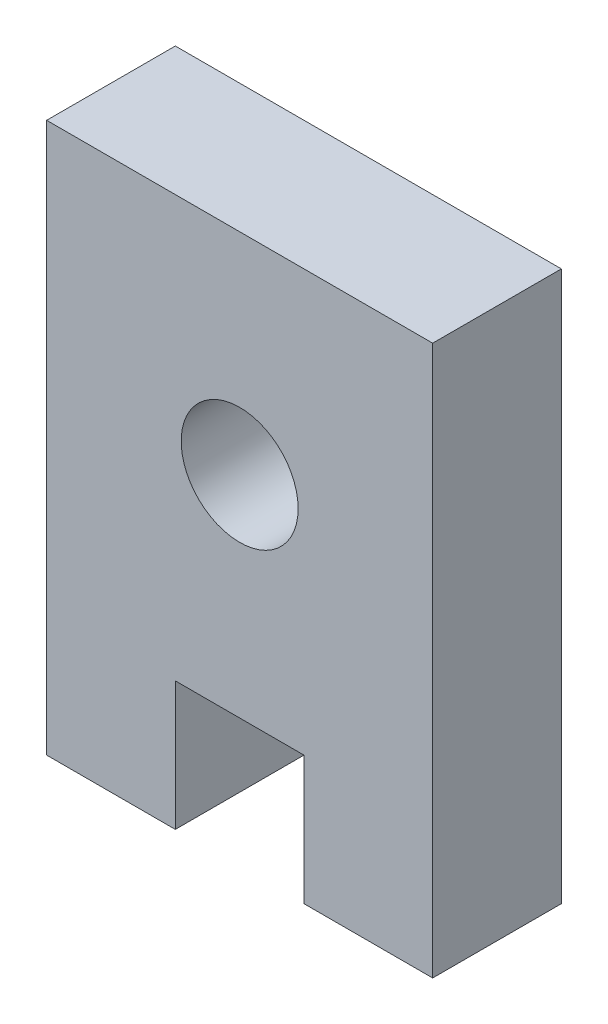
SolidWorks part; units mm, degrees
ref_plane "Front Plane" through (0, 0, 0) normal (0, 0, 1) x (1, 0, 0)
ref_plane "Top Plane" through (0, 0, 0) normal (0, 1, 0) x (1, 0, 0)
ref_plane "Right Plane" through (0, 0, 0) normal (1, 0, 0) x (0, 0, -1)
sketch "Sketch1" plane through (0, 0, 0) normal (0, 0, 1) x (1, 0, 0)
  line L0 (0, 0) -> (-16.5, 0) construction
  line L1 (-16.5, 0) -> (-16.5, 5.5) construction
  line L2 (-16.5, 5.5) -> (0, 5.5) construction
  line L3 (0, 5.5) -> (0, 0) construction
  line L4 (0, 0) -> (-5.5, 0) construction
  line L5 (-5.5, 0) -> (-5.5, 5.5) construction
  line L6 (-5.5, 5.5) -> (-11, 5.5) construction
  line L7 (-11, 5.5) -> (-11, 0) construction
  line L8 (-16.5, 5.5) -> (-16.5, 23.5) construction
  line L9 (-16.5, 23.5) -> (0, 23.5) construction
  line L10 (0, 23.5) -> (0, 5.5) construction
  line L11 (0, 5.5) -> (5.5, 5.5) construction
  line L12 (5.5, 5.5) -> (5.5, 23.5) construction
  line L13 (-16.5, 5.5) -> (-22, 5.5) construction
  line L14 (-22, 5.5) -> (-22, 23.5) construction
  line L15 (-22, 23.5) -> (5.5, 23.5) construction
  line L16 (-8.25, 5.5) -> (-8.25, 23.5) construction
  line L17 (-16.5, 0) -> (-16.5, 23.5)
  line L18 (-16.5, 23.5) -> (0, 23.5)
  line L19 (0, 23.5) -> (0, 0)
  line L20 (0, 0) -> (-5.5, 0)
  line L21 (-5.5, 0) -> (-5.5, 5.5)
  line L22 (-5.5, 5.5) -> (-11, 5.5)
  line L23 (-11, 5.5) -> (-11, 0)
  line L24 (-11, 0) -> (-16.5, 0)
  circle A0 centre (-8.25, 14.5) radius 2.5
extrude "Boss-Extrude1" add sketch "Sketch1" along normal blind 5.5
